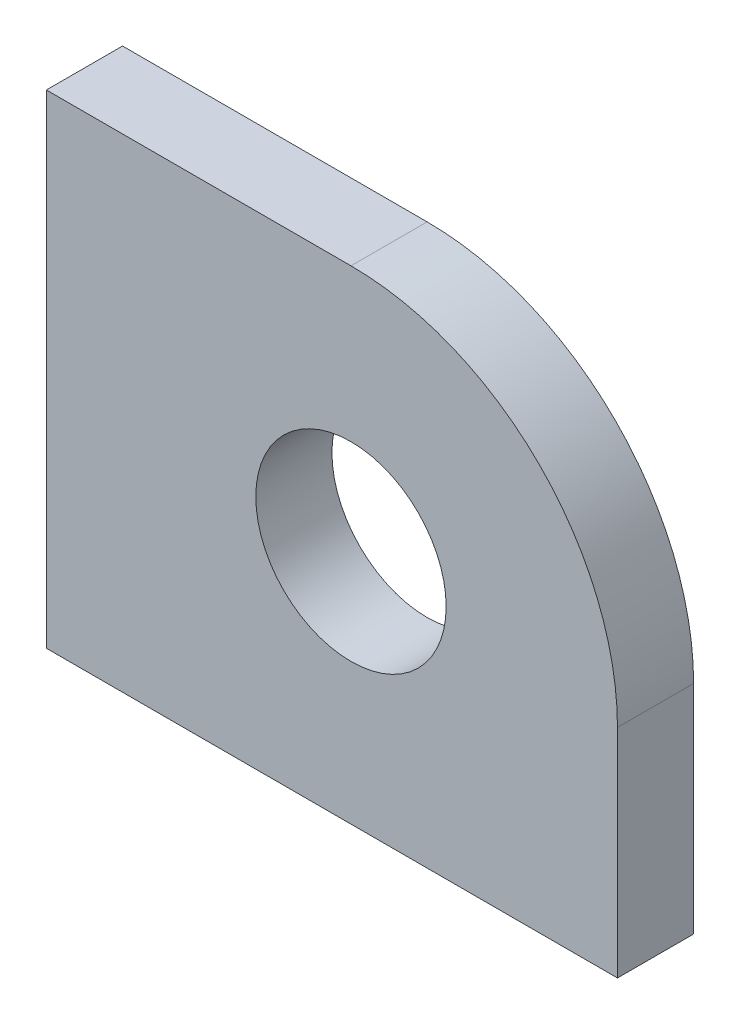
SolidWorks part; units mm, degrees
ref_plane "Plan de face" through (0, 0, 0) normal (0, 0, 1) x (1, 0, 0)
ref_plane "Plan de dessus" through (0, 0, 0) normal (0, 1, 0) x (1, 0, 0)
ref_plane "Plan de droite" through (0, 0, 0) normal (1, 0, 0) x (0, 0, -1)
sketch "Esquisse1" plane through (0, 0, 0) normal (0, 0, 1) x (1, 0, 0)
  line L1 (0, 65) -> (-80, 65)
  line L2 (70, -5) -> (70, -62)
  line L3 (70, -62) -> (-80, -62)
  line L4 (-80, 65) -> (-80, -62)
  circle A0 centre (0, 0) radius 25
  arc A1 (0, 65) -> (70, -5) centre (0, -5) cw
  dimension "D1" = 50
  dimension "D6" = 70
  dimension "D2" = 150
  dimension "D3" = 127
  dimension "D4" = 65
  dimension "D5" = 80
extrude "Extrusion1" add sketch "Esquisse1" along normal blind 20
